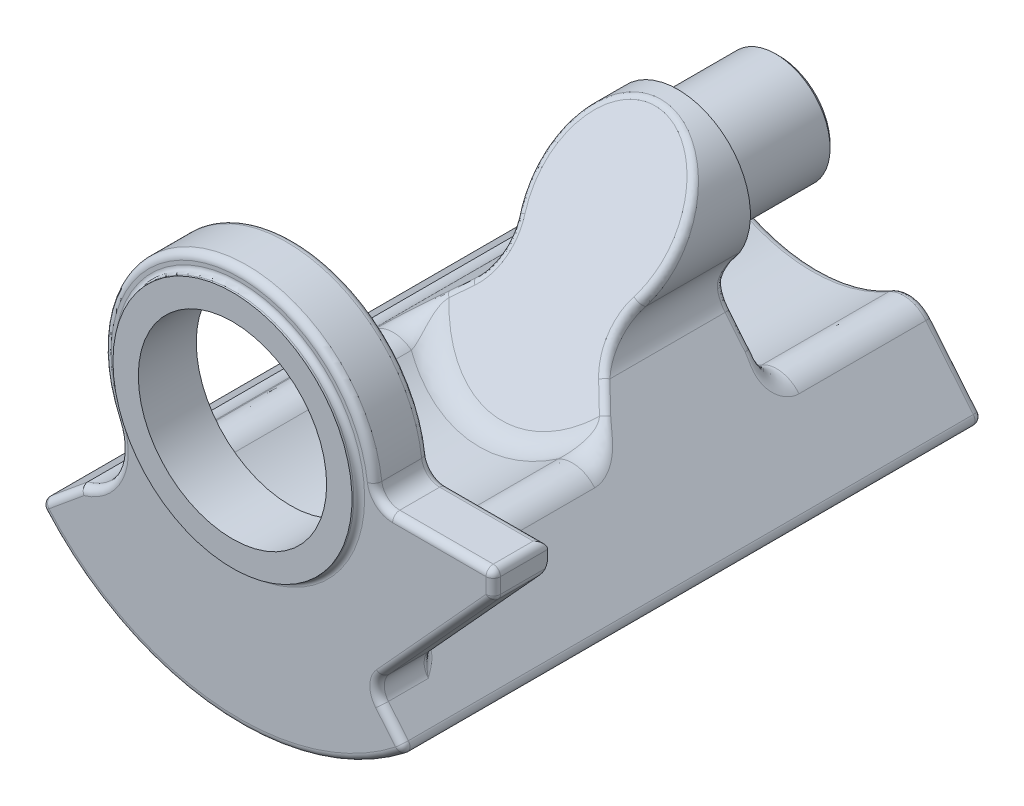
SolidWorks part; units mm, degrees
ref_plane "Plan de face" through (0, 0, 0) normal (0, 0, 1) x (1, 0, 0)
ref_plane "Plan de dessus" through (0, 0, 0) normal (0, 1, 0) x (1, 0, 0)
ref_plane "Plan de droite" through (0, 0, 0) normal (1, 0, 0) x (0, 0, -1)
other "Centre de masse"
sketch "Esquisse1" plane through (0, 0, 0) normal (0, 0, 1) x (1, 0, 0)
  line L0 (0, 57.9021) -> (0, -96.26) construction
  line L1 (0, 0) -> (108.6423, 0) construction
  line L2 (0, 0) -> (-55.5055, -45.86) construction
  line L3 (0, 0) -> (-61.5936, 0) construction
  line L4 (42.2049, 0) -> (70, 0)
  line L5 (70, 0) -> (70, -7)
  line L6 (45.86, -55.5055) -> (39.0709, -47.2886)
  line L7 (39.2313, -40.7344) -> (70, -7)
  line L8 (-55.5055, -45.86) -> (-43.9419, -36.3058)
  line L11 (45.86, -55.5055) -> (0, 0) construction
  arc A1 (37.2396, 4.4118) -> (-34.1143, -15.5713) centre (0, 0) ccw
  arc A2 (-55.5055, -45.86) -> (45.86, -55.5055) centre (0, 0) ccw
  arc A3 (39.0709, -47.2886) -> (39.2313, -40.7344) centre (42.9255, -44.1038) cw
  arc A4 (37.2396, 4.4118) -> (42.2049, 0) centre (42.2049, 5) ccw
  arc A5 (-34.1143, -15.5713) -> (-43.9419, -36.3058) centre (-47.76, -21.7999) cw
  point P18 (36.3058, -43.9419)
  point P21 (37.5, 0)
  dimension "D2" = 37.5
  dimension "D9" = 5
  dimension "D10" = 15
  dimension "D11" = 72
  dimension "D3" = 15
  dimension "D4" = 70
  dimension "D5" = 15
  dimension "D6" = 7
  dimension "D7" = 50
  dimension "D8" = 90
extrude "Boss.-Extru.1" add sketch "Esquisse1" along normal blind 15
sketch "Esquisse3" plane through (0, 0, 15) normal (0, 0, 1) x (1, 0, 0)
  circle A0 centre (0, 0) radius 33
  dimension "D1" = 66
extrude "Boss.-Extru.2" add sketch "Esquisse3" along normal blind 2
sketch "Esquisse4" plane through (0, 0, 17) normal (0, 0, 1) x (1, 0, 0)
  circle A0 centre (0, 0) radius 26
  dimension "D1" = 52
extrude "Enlèv. mat.-Extru.1" cut sketch "Esquisse4" against normal up to next
fillet "Congé1" radius 1.5 1 edges at (-33, 0, 15)
sketch "Esquisse5" plane through (0, 0, 0) normal (0, 0, -1) x (-1, 0, 0)
  line L0 (-45.86, -55.5055) -> (-24.2039, -29.2946)
  line L1 (43.9419, -36.3058) -> (55.5055, -45.86) construction
  line L2 (55.5055, -45.86) -> (43.9419, -36.3058)
  line L4 (0, 0) -> (39.7652, -34.4917) construction
  line L5 (36.3253, -31.508) -> (28.706, -24.8991)
  arc A0 (-45.86, -55.5055) -> (55.5055, -45.86) centre (0, 0) ccw
  arc A1 (-24.2039, -29.2946) -> (28.706, -24.8991) centre (0, 0) ccw
  arc A2 (43.9419, -36.3058) -> (36.3253, -31.508) centre (47.76, -21.7999) cw
  arc A3 (34.1143, -15.5713) -> (43.9419, -36.3058) centre (47.76, -21.7999) ccw construction
  dimension "D1" = 34
extrude "Boss.-Extru.3" add sketch "Esquisse5" along normal blind 145
sketch "Esquisse6" plane through (0, 0, 0) normal (0, 0, -1) x (-1, 0, 0)
  circle A0 centre (0, 0) radius 35
  dimension "D1" = 70
extrude "Enlèv. mat.-Extru.2" cut sketch "Esquisse6" against normal blind 1
sketch "Esquisse7" plane through (0, 0, -145) normal (0, 0, -1) x (-1, 0, 0)
  line L3 (-45.86, -55.5055) -> (-26.7517, -32.3782)
  line L4 (-24.2039, -29.2946) -> (-39.0709, -47.2886) construction
  line L5 (36.3253, -31.508) -> (28.706, -24.8991) construction
  line L6 (55.5055, -45.86) -> (43.9419, -36.3058)
  line L7 (36.3253, -31.508) -> (28.706, -24.8991)
  line L8 (-24.2039, -29.2946) -> (-45.86, -55.5055)
  line L9 (55.5055, -45.86) -> (43.9419, -36.3058)
  line L10 (31.7277, -27.5201) -> (36.3253, -31.508)
  arc A3 (-26.7517, -32.3782) -> (31.7277, -27.5201) centre (0, 0) ccw
  arc A6 (-45.86, -55.5055) -> (55.5055, -45.86) centre (0, 0) ccw
  arc A7 (36.3253, -31.508) -> (43.9419, -36.3058) centre (47.76, -21.7999) ccw
  arc A8 (-24.2039, -29.2946) -> (28.706, -24.8991) centre (0, 0) ccw
  arc A9 (-45.86, -55.5055) -> (55.5055, -45.86) centre (0, 0) ccw
  arc A10 (36.3253, -31.508) -> (43.9419, -36.3058) centre (47.76, -21.7999) ccw
  dimension "D2" = 30
  dimension "D1" = 0
extrude "Enlèv. mat.-Extru.3" cut sketch "Esquisse7" against normal blind 42 flip side to cut
ref_plane "Plan1" through (0, 0, -55) normal (0, 0, 1) x (1, 0, 0)
sketch "Esquisse17" plane through (0, 0, -55) normal (0, 0, 1) x (1, 0, 0)
  line L0 (0, -38) -> (-33.3969, -38) construction
  arc A3 (-28.706, -24.8991) -> (24.2039, -29.2946) centre (0, 0) ccw construction
  arc A4 (-28.706, -24.8991) -> (24.2039, -29.2946) centre (0, 0) ccw construction
ref_plane "Plan2" through (0, -41.0866, -52.5885) normal (0, 0.6157, 0.788) x (1, 0, 0)
sketch "Esquisse9" plane through (0, 0, -103) normal (0, 0, -1) x (-1, 0, 0)
  line L0 (-26.7517, -32.3782) -> (0, 0) construction
  line L2 (0, 0) -> (30.2168, -26.2096) construction
  line L3 (31.7277, -27.5201) -> (28.706, -24.8991) construction
  line L4 (-26.7517, -32.3782) -> (-12.7389, -15.4182)
  line L5 (31.7277, -27.5201) -> (15.1084, -13.1048)
  arc A0 (-12.7389, -15.4182) -> (15.1084, -13.1048) centre (0, 0) cw
  arc A1 (-26.7517, -32.3782) -> (31.7277, -27.5201) centre (0, 0) ccw
  arc A2 (-26.7517, -32.3782) -> (31.7277, -27.5201) centre (0, 0) ccw construction
  dimension "D1" = 20
extrude "Boss.-Extru.4" add sketch "Esquisse9" against normal up to surface (37.7645 mm away) contours A0 L4 L5 M4
sketch "Esquisse10" plane through (0, 0, -103) normal (0, 0, -1) x (-1, 0, 0)
  circle A0 centre (0, 0) radius 20
  dimension "D1" = 40
extrude "Boss.-Extru.5" add sketch "Esquisse10" along normal blind 3
sketch "Esquisse11" plane through (0, 0, -106) normal (0, 0, -1) x (-1, 0, 0)
  circle A0 centre (0, 0) radius 15
  dimension "D1" = 30
extrude "Boss.-Extru.6" add sketch "Esquisse11" along normal blind 28
chamfer "Chanfrein1" distance 1 angle 45 1 edges at (-15, 0, -134)
fillet "Congé2" radius 5 1 edges at (-3.4771, -41.8558, -103)
fillet "Congé3" radius 2 29 edges at (-55.5055, -45.86, -65) (45.86, -55.5055, -65) (-6.8204, -71.6762, -145) (-6.8204, -71.6762, 15) (36.3058, -43.9419, -145) (-3.4771, -41.8558, -145) (-34.0265, -29.5141, -145) (-39.7652, -34.4917, -145) (-49.7237, -41.0829, -145) (38.8838, 1.2623, 15) (-10.113, 36.1106, 15) (-34.2054, -28.2244, 15) (-49.7237, -41.0829, 15) (42.4654, -51.397, 15) (37.927, -43.9815, 15) (54.6156, -23.8672, 15) (70, -3.5, 15) (56.1024, 0, 15) (70, -7, 7.5) (70, 0, 7.5) (54.6156, -23.8672, 0) (-10.113, 36.1106, 0) (38.8838, 1.2623, 0) (56.1024, 0, 0)
fillet "Congé4" radius 2.5 1 edges at (-1.6558, -19.9313, -103)
fillet "Congé8" radius 10 2 edges at (-15.1084, -13.1048, -89.9751) (12.7389, -15.4182, -89.0714)
fillet "Congé19" radius 8 1 edges at (-3.146, -37.8695, -55.1019)
fillet "Congé variable1" radius 8 5 edges at (26.7517, -32.3782, -125.5) (15.7688, -14.4956, -103.2457) (16.4275, -19.1182, -103) (20.7912, -25.1641, -103) (25.8189, -31.2492, -104.4645)
fillet "Congé variable7" radius 8 9 edges at (-23.146, -20.0765, -69.0033) (-28.706, -24.8991, -30.5894) (24.2039, -29.2946, -29.2338) (-27.0085, -23.4268, -65.5498) (-18.2075, -13.3637, -74.248) (1.6558, 19.9313, -100.2609) (15.7527, -16.185, -72.0438) (19.7188, -23.8661, -66.0426) (23.7943, -28.7989, -59.922)
fillet "Congé21" radius 6 6 edges at (-31.753, -27.8845, -143.9838) (-17.9446, -11.6949, -103.2457) (-19.357, -16.1454, -103) (-24.6585, -21.3884, -103) (-30.6214, -26.5605, -104.4645) (-31.7277, -27.5201, -125.5)
